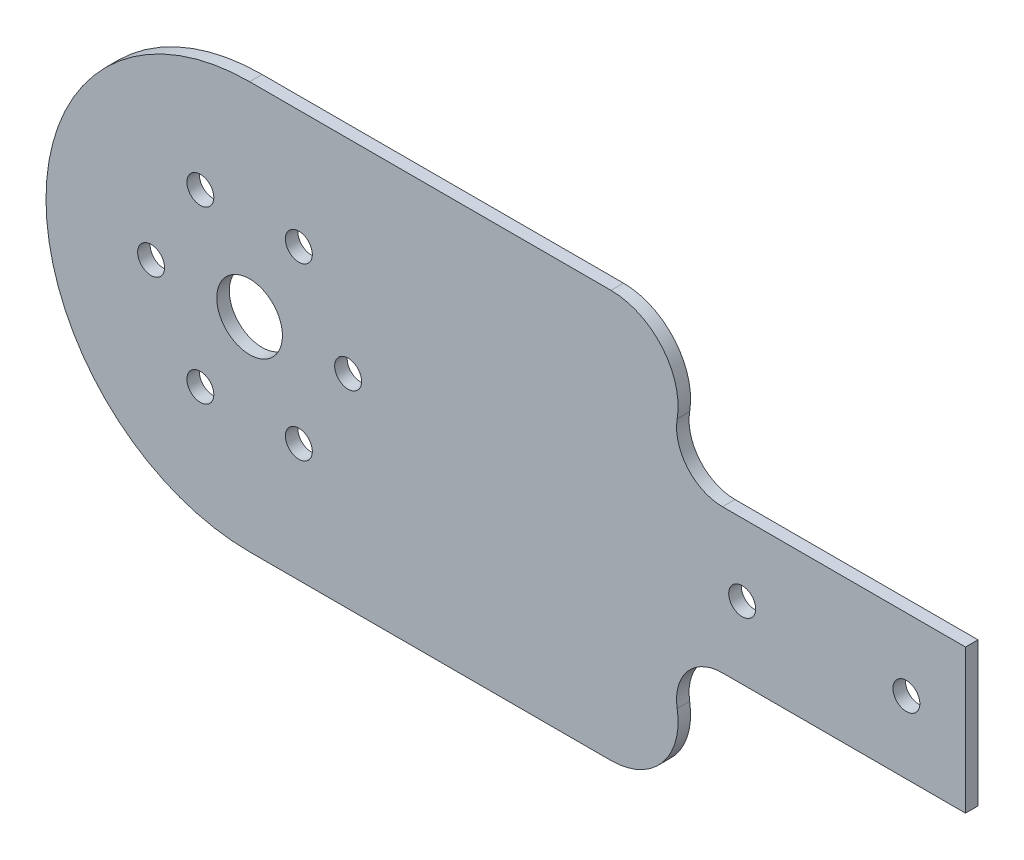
SolidWorks part; units mm, degrees
ref_plane "Front Plane" through (0, 0, 0) normal (1, 0, 0) x (0, 1, 0)
ref_plane "Top Plane" through (0, 0, 0) normal (0, 0, 1) x (0, 1, 0)
ref_plane "Right Plane" through (0, 0, 0) normal (0, 1, 0) x (-1, 0, 0)
sketch "Sketch1" plane through (0, 0, 0) normal (0, 0, 1) x (0, 1, 0)
  line L0 (-31, 0) -> (-31, -55.02)
  line L1 (-10.955, -72) -> (-10.955, -109)
  line L2 (-10.955, -109) -> (10.955, -109)
  line L3 (10.955, -109) -> (10.955, -72)
  line L4 (31, -55.02) -> (31, 0)
  arc A0 (-31, 0) -> (31, 0) centre (0, 0) cw
  arc A2 (-19.0979, -65.1022) -> (-10.955, -72) centre (-17.948, -72) cw
  arc A3 (10.955, -72) -> (19.0979, -65.1022) centre (17.948, -72) cw
  arc A5 (-31, -55.02) -> (-19.0979, -65.1022) centre (-20.7787, -55.02) ccw
  arc A6 (31, -55.02) -> (19.0979, -65.1022) centre (20.7787, -55.02) cw
  point P16 (0, -109)
  dimension "D1" = 31
  dimension "D5" = 140
  dimension "D2" = 55.02
  dimension "D3" = 37
  dimension "D4" = 21.91
extrude "Boss-Extrude1" add sketch "Sketch1" along normal blind 1.905
sketch "Sketch2" plane through (0, 0, 1.905) normal (0, 0, 1) x (1, 0, 0)
  line L0 (0, 0) -> (-15, 0) construction
  line L1 (109, -10.955) -> (109, 10.955) construction
  circle A0 centre (-15, 0) radius 2.05
  circle A1 centre (-7.5, 12.9904) radius 2.05
  circle A2 centre (7.5, 12.9904) radius 2.05
  circle A3 centre (15, 0) radius 2.05
  circle A4 centre (7.5, -12.9904) radius 2.05
  circle A5 centre (-7.5, -12.9904) radius 2.05
  circle A6 centre (100, 0) radius 2.05
  circle A7 centre (75, 0) radius 2.05
  point P20 (109, 0)
  dimension "D1" = 4.1
  dimension "D5" = 25
  dimension "D6" = 4.1
  dimension "D2" = 15
  dimension "D4" = 9
  dimension "D3" = 6
extrude "Cut-Extrude1" cut sketch "Sketch2" against normal through all
sketch "Sketch3" plane through (0, 0, 1.905) normal (0, 0, 1) x (1, 0, 0)
  circle A0 centre (0, 0) radius 5
  dimension "D1" = 10
extrude "Cut-Extrude2" cut sketch "Sketch3" against normal through all
